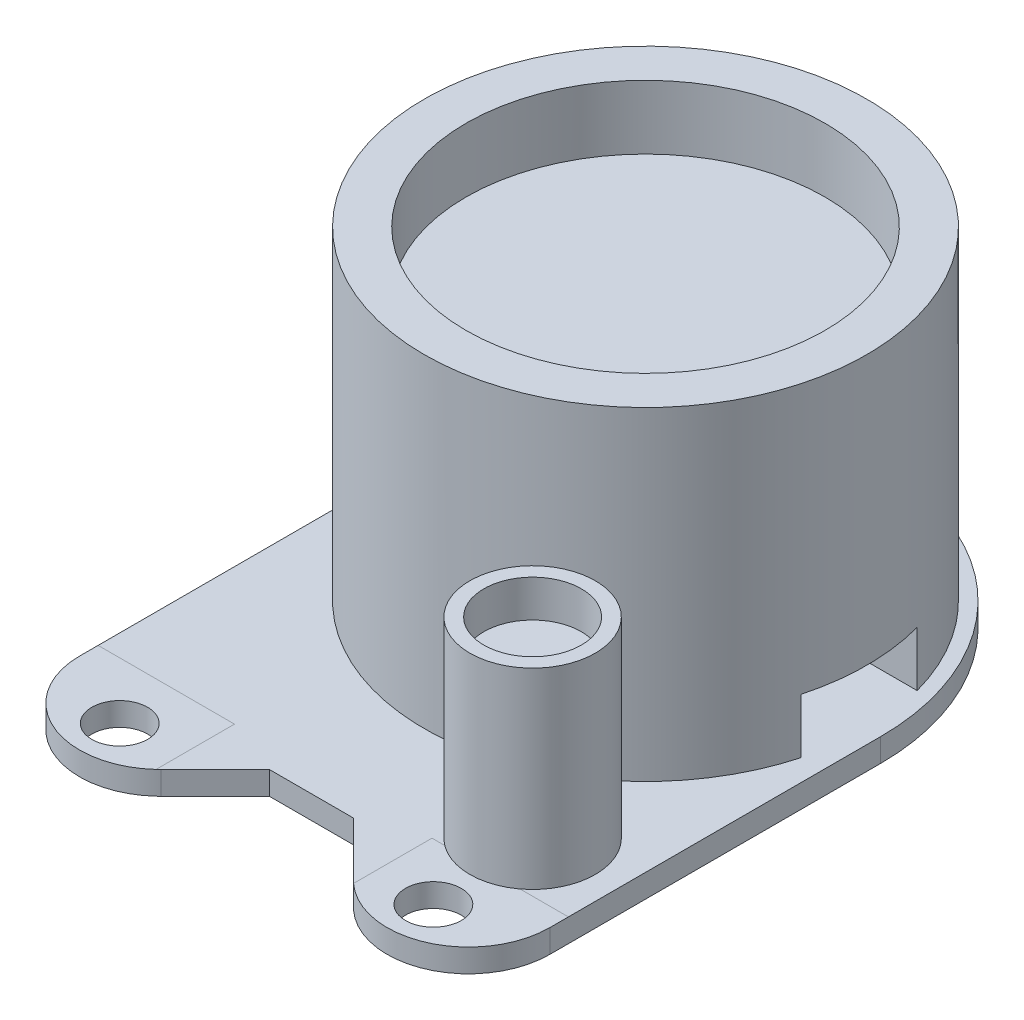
SolidWorks part; units mm, degrees
ref_plane "Front" through (0, 0, 0) normal (0, 0, 1) x (1, 0, 0)
ref_plane "Top" through (0, 0, 0) normal (0, 1, 0) x (1, 0, 0)
ref_plane "Right" through (0, 0, 0) normal (1, 0, 0) x (0, 0, -1)
sketch "Sketch1" plane through (0, 0, 0) normal (0, 1, 0) x (1, 0, 0)
  line L0 (-10.12, 0) -> (-10.12, -14.24)
  line L1 (10.12, 0) -> (10.12, -14.24)
  line L2 (-6.62, -17.74) -> (6.62, -17.74) construction
  line L3 (0, -0.8108) -> (0, -50000.8108) construction
  line L4 (-1.8103, -14.38) -> (1.8103, -14.38)
  line L5 (-4.1451, -16.7149) -> (-1.8103, -14.38)
  line L6 (1.8103, -14.38) -> (4.1451, -16.7149)
  arc A0 (10.12, 0) -> (-10.12, 0) centre (0, 0) ccw
  circle A1 centre (-6.75, -15.88) radius 1.2
  circle A2 centre (6.75, -15.88) radius 1.2
  arc A3 (-4.1451, -16.7149) -> (-10.12, -14.24) centre (-6.62, -14.24) cw
  arc A4 (4.1451, -16.7149) -> (10.12, -14.24) centre (6.62, -14.24) ccw
  point P14 (0, 0)
  point P19 (-6.1206, -18.7584)
  dimension "D1" = 20.24
  dimension "D2" = 27.86
  dimension "D3" = 2.4
  dimension "D4" = 13.5
  dimension "D7" = 26
  dimension "D6" = 0.66
  dimension "D8" = 3.5
  dimension "D9" = 3.5
  dimension "D5" = 24.5
  dimension "D10" = 45
extrude "Boss-Extrude1" add sketch "Sketch1" along normal blind 1
sketch "Sketch2" plane through (0, 1, 0) normal (0, 1, 0) x (1, 0, 0)
  line L0 (0, 0) -> (0, -50000) construction
  line L1 (0, 0) -> (50000, 0) construction
  line L3 (10.12, -14.24) -> (10.12, 0) construction
  line L4 (-4.25, -13.44) -> (-10.12, -13.44)
  line L5 (10.12, -14.24) -> (10.12, -13.44)
  line L6 (4.25, -13.44) -> (4.25, -16.8155)
  line L7 (4.25, -13.44) -> (10.12, -13.44)
  line L8 (-4.25, -13.44) -> (-4.25, -16.8155)
  line L9 (-10.12, -14.24) -> (-10.12, -13.44)
  arc A0 (4.1451, -16.7149) -> (10.12, -14.24) centre (6.62, -14.24) ccw construction
  arc A1 (4.25, -16.8155) -> (10.12, -14.24) centre (6.62, -14.24) ccw
  arc A2 (-4.25, -16.8155) -> (-10.12, -14.24) centre (-6.62, -14.24) cw
  dimension "D2" = 4.3
  dimension "D1" = 8.5
sketch "Sketch3" plane through (0, 0, 0) normal (0, -1, 0) x (1, 0, 0)
  line L0 (0, 0) -> (50000, 0) construction
  line L1 (0, 0) -> (3.75, 0) construction
  line L2 (0, 0) -> (2.6517, -2.6517) construction
  circle A0 centre (0, 0) radius 4.25
  circle A1 centre (0, 0) radius 3.75 construction
  circle A3 centre (3.75, 0) radius 0.15
  circle A4 centre (2.6517, -2.6517) radius 0.15
  circle A5 centre (0, -3.75) radius 0.15
  circle A6 centre (-2.6517, -2.6517) radius 0.15
  circle A7 centre (-3.75, 0) radius 0.15
  circle A8 centre (-2.6517, 2.6517) radius 0.15
  circle A9 centre (0, 3.75) radius 0.15
  circle A10 centre (2.6517, 2.6517) radius 0.15
  point P4 (0, 0)
  dimension "D1" = 8.5
  dimension "D2" = 7.5
  dimension "D3" = 0.3
  dimension "D5" = 45
  dimension "D4" = 8
sketch "Sketch4" plane through (0, 1, 0) normal (0, 1, 0) x (1, 0, 0)
  circle A0 centre (0, 0) radius 9.525
  circle A1 centre (0, 0) radius 7.725
  point P2 (0, 0)
  dimension "D1" = 19.05
  dimension "D2" = 1.8
extrude "Boss-Extrude2" add sketch "Sketch4" along normal blind 13.94 separate body
sketch "Sketch5" plane through (0, 0, 0) normal (1, 0, 0) x (0, 0, -1)
  line L0 (0, 11.4963) -> (0, -49988.5037) construction
  line L2 (0, 14.94) -> (0, 1) construction
  line L3 (-13.44, 1) -> (0, 1) construction
  line L4 (-2.5, 1) -> (2.5, 1)
  line L5 (-2.5, 1) -> (-2.5, 3.36)
  line L6 (-2.5, 3.36) -> (2.5, 3.36)
  line L7 (2.5, 1) -> (2.5, 3.36)
  dimension "D1" = 5
  dimension "D2" = 2.36
extrude "Cut-Extrude1" cut sketch "Sketch5" against normal through all both and the other way through all
sketch "Sketch6" plane through (0, 14.94, 0) normal (0, 1, 0) x (1, 0, 0)
  circle A0 centre (0, 0) radius 7.725 construction
  circle A1 centre (0, 0) radius 7.725
extrude "Boss-Extrude3" add sketch "Sketch6" against normal up to surface (8.83 mm away) from offset 2.75 separate body
sketch "Sketch7" plane through (0, 1, 0) normal (0, 1, 0) x (1, 0, 0)
  line L0 (10.12, -13.44) -> (10.12, 0) construction
  circle A0 centre (6.42, -11.28) radius 2.7
  arc A1 (4.25, -16.8155) -> (10.12, -14.24) centre (6.62, -14.24) ccw construction
  dimension "D1" = 5.4
  dimension "D2" = 3.7
  dimension "D3" = 3.76
extrude "Extrude-Thin1" add sketch "Sketch7" along normal blind 8.25 separate body thin
sketch "Sketch8" plane through (0, 9.25, 0) normal (0, 1, 0) x (1, 0, 0)
  circle A0 centre (6.42, -11.28) radius 2.1 construction
  circle A3 centre (6.42, -11.28) radius 2.1
extrude "Boss-Extrude4" add sketch "Sketch8" against normal up to surface (6.65 mm away) from offset 1.6
sketch "Sketch9" plane through (0, 1, 0) normal (0, -1, 0) x (1, 0, 0)
  circle A0 centre (0, 0) radius 4
  dimension "D1" = 8
extrude "Cut-Extrude2" cut sketch "Sketch9" against normal blind 6.45
fillet "Fillet1" radius 4 1 edges at (0, 7.45, -4)
sketch "Sketch10" plane through (0, 1, 0) normal (0, -1, 0) x (1, 0, 0)
  line L0 (7.3093, -2.5) -> (9.1911, -2.5) construction
  line L1 (7.3093, 2.5) -> (9.1911, 2.5) construction
  line L2 (-7.3093, -2.5) -> (-3.1225, -2.5)
  line L3 (-7.3093, 2.5) -> (-3.1225, 2.5)
  line L4 (3.1225, 2.5) -> (7.3093, 2.5)
  line L5 (3.1225, -2.5) -> (7.3093, -2.5)
  arc A0 (-7.3093, -2.5) -> (7.3093, -2.5) centre (0, 0) ccw construction
  arc A1 (7.3093, 2.5) -> (-7.3093, 2.5) centre (0, 0) ccw construction
  arc A2 (-7.3093, -2.5) -> (7.3093, -2.5) centre (0, 0) ccw
  arc A3 (7.3093, 2.5) -> (-7.3093, 2.5) centre (0, 0) ccw
  circle A4 centre (0, 0) radius 4 construction
  arc A5 (-3.1225, -2.5) -> (3.1225, -2.5) centre (0, 0) ccw
  arc A6 (3.1225, 2.5) -> (-3.1225, 2.5) centre (0, 0) ccw
extrude "Boss-Extrude5" add sketch "Sketch10" against normal up to surface (2.36 mm away)
